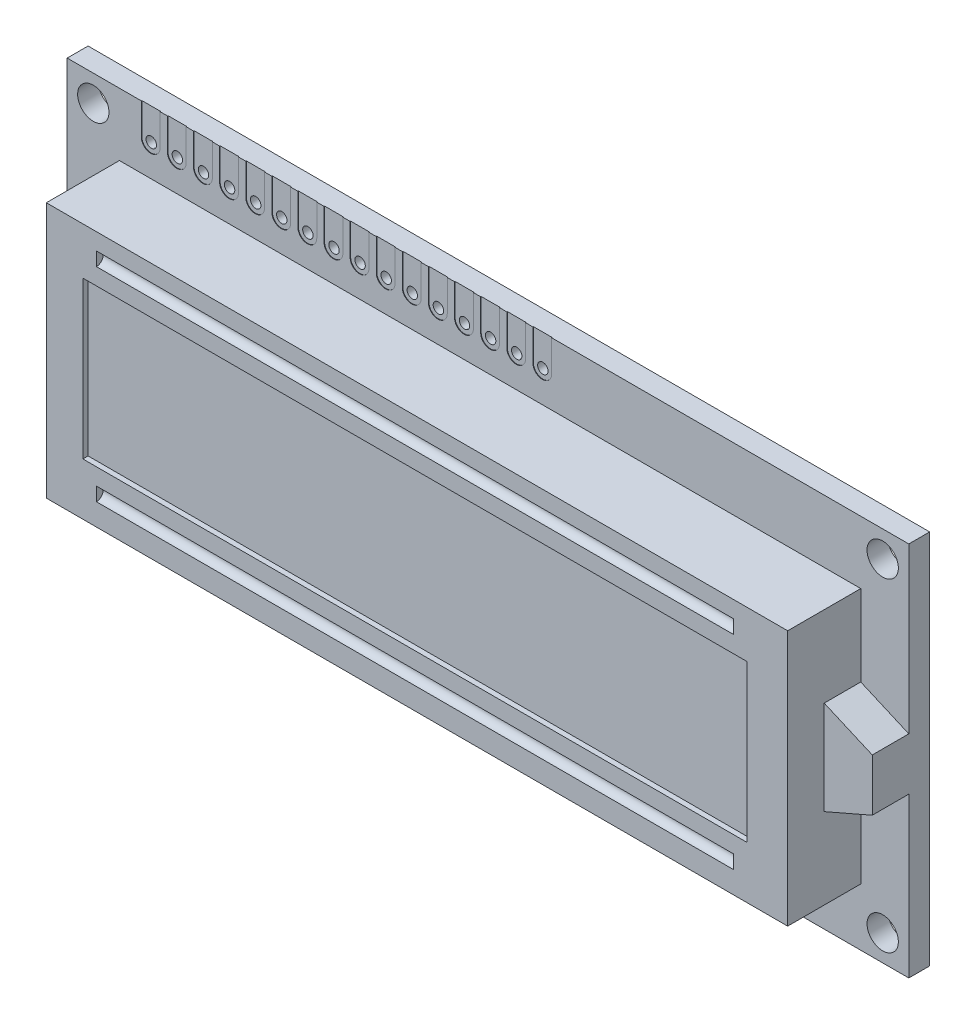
SolidWorks part; units mm, degrees
ref_plane "Alzado" through (0, 0, 0) normal (0, 0, 1) x (1, 0, 0)
ref_plane "Planta" through (0, 0, 0) normal (0, 1, 0) x (1, 0, 0)
ref_plane "Vista lateral" through (0, 0, 0) normal (1, 0, 0) x (0, 0, -1)
sketch "Croquis1" plane through (0, 0, 0) normal (0, 0, 1) x (1, 0, 0)
  line L0 (0, 0) -> (0, 8.4176) construction
  line L1 (-40.3, 18) -> (40.3, 18)
  line L2 (-40.3, 18) -> (-40.3, -18)
  line L3 (-40.3, -18) -> (40.3, -18)
  line L4 (40.3, 18) -> (40.3, -18)
  line L5 (-40.3, 18) -> (40.3, -18) construction
  line L6 (-40.3, -18) -> (40.3, 18) construction
  line L7 (0, 0) -> (-8.4257, 0) construction
  circle A0 centre (37.8, 15.5) radius 1.5
  circle A1 centre (-37.8, 15.5) radius 1.5
  circle A2 centre (37.8, -15.5) radius 1.5
  circle A3 centre (-37.8, -15.5) radius 1.5
  point P0 (0, 0)
  dimension "D3" = 2.5
  dimension "D1" = 80.6
  dimension "D2" = 36
  dimension "D4" = 2.5
extrude "Saliente-Extruir1" add sketch "Croquis1" along normal blind 2
sketch "Croquis2" plane through (0, 0, 2) normal (0, 0, 1) x (1, 0, 0)
  line L5 (-40.3, 18) -> (-40.3, -18) construction
  line L6 (-35.3, 12) -> (35.7, 12)
  line L7 (-35.3, 12) -> (-35.3, -12.5)
  line L8 (-35.3, -12.5) -> (35.7, -12.5)
  line L9 (35.7, 12) -> (35.7, -12.5)
  line L10 (-35.3, 12) -> (35.7, -12.5) construction
  line L11 (-35.3, -12.5) -> (35.7, 12) construction
  line L12 (-40.3, -18) -> (40.3, -18) construction
  point P0 (0.2, -0.25)
  dimension "D1" = 71
  dimension "D2" = 24.5
  dimension "D3" = 5
  dimension "D4" = 5.5
extrude "Saliente-Extruir2" add sketch "Croquis2" along normal blind 7
sketch "Croquis3" plane through (0, 0, 9) normal (0, 0, 1) x (1, 0, 0)
  line L0 (-35.3, 12) -> (-35.3, -12.5) construction
  line L1 (-31.8, 7.5) -> (31.8, 7.5)
  line L2 (-31.8, 7.5) -> (-31.8, -7.5)
  line L3 (-31.8, -7.5) -> (31.8, -7.5)
  line L4 (31.8, 7.5) -> (31.8, -7.5)
  line L5 (-31.8, 7.5) -> (31.8, -7.5) construction
  line L6 (-31.8, -7.5) -> (31.8, 7.5) construction
  line L7 (-35.3, -12.5) -> (35.7, -12.5) construction
  point P0 (0, 0)
  dimension "D1" = 3.5
  dimension "D2" = 5
extrude "Cortar-Extruir1" cut sketch "Croquis3" against normal blind 0.5
sketch "Croquis4" plane through (0, 0, 0) normal (1, 0, 0) x (0, 0, -1)
  line L0 (-9, 12) -> (-9, 7.5) construction
  line L1 (0, 0) -> (-6.02, 0) construction
  line L2 (-9, 10.4014) -> (-9, 9.0981)
  line L3 (-9, -10.4014) -> (-9, -9.0981)
  arc A0 (-9, 9.0986) -> (-9, 10.4014) centre (-9, 9.75) ccw
  arc A1 (-9, -9.0986) -> (-9, -10.4014) centre (-9, -9.75) cw
extrude "Cortar-Extruir2" cut sketch "Croquis4" against normal blind 30.5 and the other way blind 30.5 contours L2 A0 | A1 L3
sketch "Croquis5" plane through (0, 0, 2) normal (0, 0, 1) x (1, 0, 0)
  line L0 (35.7, -0.25) -> (40.3, -0.25) construction
  line L3 (35.7, -12.5) -> (35.7, 12) construction
  line L4 (35.7, 4.25) -> (40.3, 2.25)
  line L5 (40.3, -18) -> (40.3, 18) construction
  line L6 (40.3, 2.25) -> (40.3, -2.75)
  line L7 (35.7, -4.75) -> (35.7, 4.25)
  line L8 (35.7, -4.75) -> (40.3, -2.75)
  dimension "D1" = 2.5
  dimension "D2" = 4.5
extrude "Saliente-Extruir3" add sketch "Croquis5" along normal blind 3.5
sketch "Croquis6" plane through (0, 0, 2) normal (0, 0, 1) x (1, 0, 0)
  line L0 (40.3, 18) -> (-40.3, 18) construction
  line L2 (-37.8, 17) -> (-37.8, 14) construction
  circle A0 centre (-32.3, 15) radius 0.5
  circle A1 centre (-37.8, 15.5) radius 1.5 construction
  circle A2 centre (-29.8, 15) radius 0.5
  circle A3 centre (-27.3, 15) radius 0.5
  circle A4 centre (-24.8, 15) radius 0.5
  circle A5 centre (-22.3, 15) radius 0.5
  circle A6 centre (-19.8, 15) radius 0.5
  circle A7 centre (-17.3, 15) radius 0.5
  circle A8 centre (-14.8, 15) radius 0.5
  circle A9 centre (-12.3, 15) radius 0.5
  circle A10 centre (-9.8, 15) radius 0.5
  circle A11 centre (-7.3, 15) radius 0.5
  circle A12 centre (-4.8, 15) radius 0.5
  circle A13 centre (-2.3, 15) radius 0.5
  circle A14 centre (0.2, 15) radius 0.5
  circle A15 centre (2.7, 15) radius 0.5
  circle A16 centre (5.2, 15) radius 0.5
  point P6 (-37.8, 15.5)
  dimension "D1" = 3
  dimension "D2" = 5.5
  dimension "D3" = 16
extrude "Cortar-Extruir3" cut sketch "Croquis6" against normal blind 3.5
sketch "Croquis8" plane through (0, 0, 2) normal (0, 0, 1) x (1, 0, 0)
  line L0 (-33.2, 15) -> (-33.2, 18)
  line L1 (40.3, 18) -> (-40.3, 18) construction
  line L2 (-31.4, 15) -> (-31.4, 18)
  line L3 (-31.4, 18) -> (-33.2, 18)
  circle A0 centre (-32.3, 15) radius 0.5 construction
  circle A1 centre (-32.3, 15) radius 0.5
  arc A2 (-33.2, 15) -> (-31.4, 15) centre (-32.3, 15) ccw
  circle A3 centre (-32.3, 15) radius 0.9 construction
  dimension "D1" = 0.4
extrude "Cortar-Extruir4" cut sketch "Croquis8" against normal blind 0.05
pattern_linear "MatrizL1" count 16 spacing 2.5 along (1, 0, 0) of "Cortar-Extruir4"
sketch "Sketch1" plane through (0, 0, 9) normal (0, 0, 1) x (1, 0, 0)
  line L12 (31.8, -7.5) -> (31.8, 7.5)
  line L13 (31.8, 7.5) -> (-31.8, 7.5)
  line L14 (-31.8, 7.5) -> (-31.8, -7.5)
  line L15 (-31.8, -7.5) -> (31.8, -7.5)
  line L16 (31.8, -7.5) -> (31.8, 7.5)
  line L17 (31.8, 7.5) -> (-31.8, 7.5)
  line L18 (-31.8, 7.5) -> (-31.8, -7.5)
  line L19 (-31.8, -7.5) -> (31.8, -7.5)
  dimension "D1" = 0
